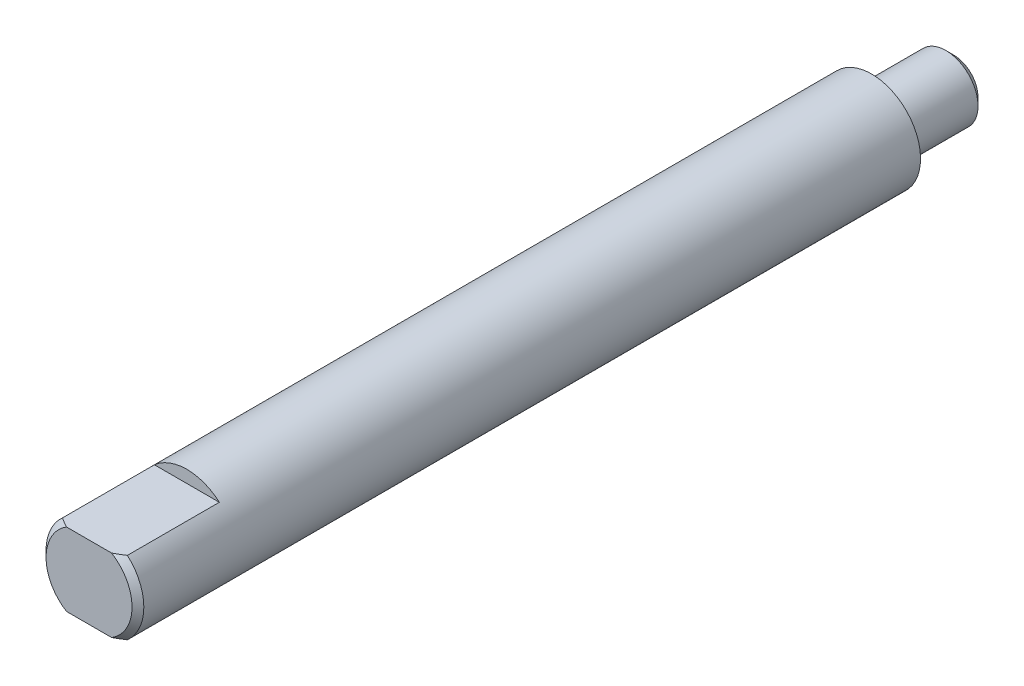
SolidWorks part; units mm, degrees
ref_plane "Front" through (0, 0, 0) normal (0, 0, 1) x (1, 0, 0)
ref_plane "Top" through (0, 0, 0) normal (0, 1, 0) x (1, 0, 0)
ref_plane "Right" through (0, 0, 0) normal (1, 0, 0) x (0, 0, -1)
sketch "Sketch1" plane through (0, 0, 0) normal (1, 0, 0) x (0, 0, -1)
  line L0 (52.07, 1.57) -> (51.56, 2.0828)
  line L1 (-4.064, 0) -> (52.07, 0)
  line L2 (-4.064, 0) -> (-4.064, 2.79)
  line L3 (-3.684, 3.175) -> (46.736, 3.175)
  line L4 (46.736, 2.0828) -> (46.736, 3.175)
  line L5 (153.7208, 0) -> (-49846.2792, 0) construction
  line L6 (-4.064, 2.79) -> (-3.684, 3.175)
  line L7 (46.736, 2.0828) -> (51.56, 2.0828)
  line L8 (52.07, 0) -> (52.07, 1.57)
  point P2 (0, 0)
  point P12 (-19.0104, 12.9241)
  dimension "D1" = 50.8
  dimension "D2" = 3.175
  dimension "D3" = 4.1656
  dimension "D4" = 5.334
  dimension "D5" = 1.57
  dimension "D6" = 0.51
  dimension "D7" = 2.79
  dimension "D8" = 0.38
  dimension "D9" = 4.064
revolve "Revolve1" add sketch "Sketch1" angle 360 about L1
sketch "Sketch2" plane through (0, 0, 0) normal (1, 0, 0) x (0, 0, -1)
  line L0 (-4.064, 2.79) -> (-4.064, -2.79) construction
  line L1 (-4.064, 2.375) -> (2.286, 2.375)
  line L2 (-4.064, 2.375) -> (-4.064, 3.175)
  line L3 (-4.064, 3.175) -> (2.286, 3.175)
  line L4 (2.286, 2.375) -> (2.286, 3.175)
  line L5 (46.736, 3.175) -> (-3.684, 3.175) construction
  line L6 (0, 0) -> (6.0811, 0) construction
  line L7 (2.286, -2.375) -> (2.286, -3.175)
  line L8 (-4.064, -3.175) -> (2.286, -3.175)
  line L9 (-4.064, -2.375) -> (-4.064, -3.175)
  line L10 (-4.064, -2.375) -> (2.286, -2.375)
  dimension "D1" = 0.8
  dimension "D2" = 6.35
extrude "Cut-Extrude1" cut sketch "Sketch2" against normal mid plane 10
